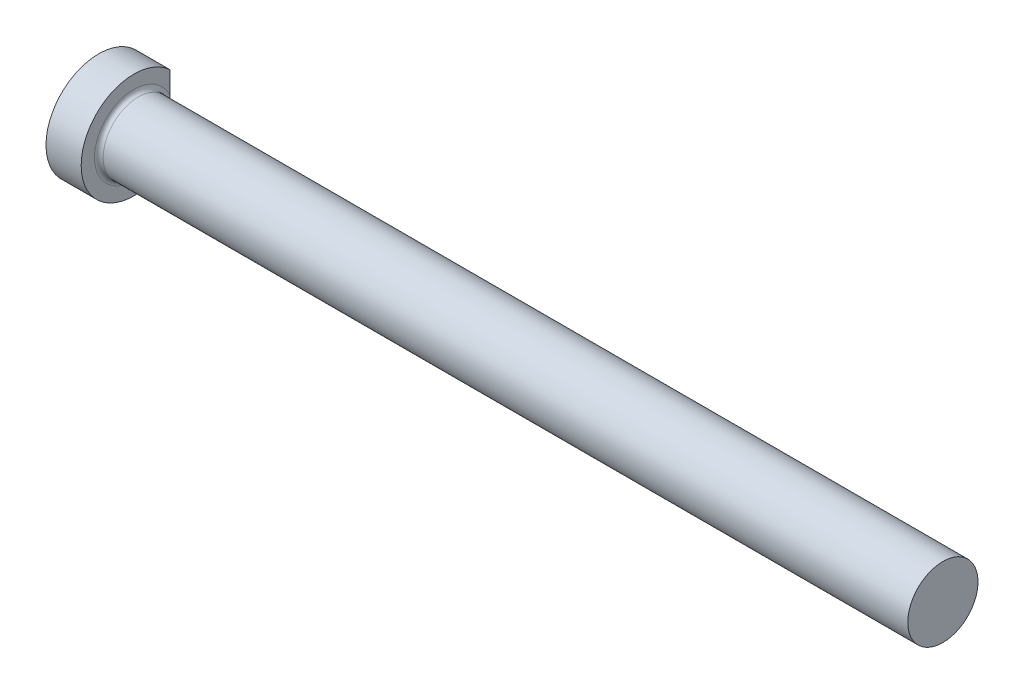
SolidWorks part; units mm, degrees
ref_plane "Front Plane" through (0, 0, 0) normal (0, 0, 1) x (1, 0, 0)
ref_plane "Top Plane" through (0, 0, 0) normal (0, 1, 0) x (1, 0, 0)
ref_plane "Right Plane" through (0, 0, 0) normal (1, 0, 0) x (0, 0, -1)
sketch "Sketch1" plane through (0, 0, 0) normal (0, 0, 1) x (1, 0, 0)
  line L0 (0, 0) -> (0, 9.525)
  line L1 (0, 9.525) -> (6.35, 9.525)
  line L2 (6.35, 9.525) -> (6.35, 7.1311)
  line L3 (7.1374, 6.3437) -> (152.4, 6.3437)
  line L4 (152.4, 6.3437) -> (152.4, 0)
  line L5 (152.4, 0) -> (0, 0)
  line L6 (152.4, 0) -> (0, 0) construction
  line L7 (0, 0) -> (-10.4771, 0) construction
  line L8 (152.4, 0) -> (1002.3976, 0) construction
  line L9 (7.1374, 6.3437) -> (-7.9138, 6.3436) construction
  arc A0 (7.1374, 6.3437) -> (6.35, 7.1311) centre (7.1374, 7.1311) cw
  dimension "D1" = 0.7874
  dimension "HeadDia" = 19.05
  dimension "HeadThickness" = 6.35
  dimension "PinDia" = 12.6873
  dimension "overall" = 152.4
revolve "PIN" add sketch "Sketch1" angle 360 about L6
ref_plane "Plane1" through (79.7687, 0, -6.3437) normal (0, 0, -1) x (0, -1, 0)
ref_plane "CutPlane" through (0, 0, -6.5215) normal (0, 0, -1) x (-1, 0, 0)
other "SurfaceCut1"
